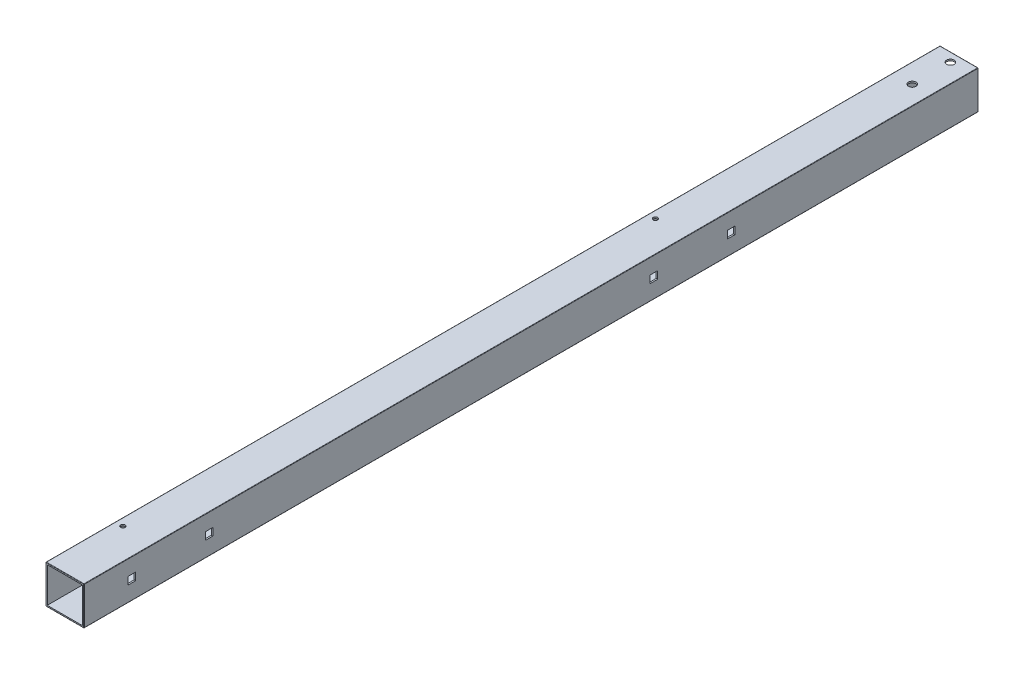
SolidWorks part; units mm, degrees
ref_plane "Plan de face" through (0, 0, 0) normal (0, 0, 1) x (1, 0, 0)
ref_plane "Plan de dessus" through (0, 0, 0) normal (0, 1, 0) x (1, 0, 0)
ref_plane "Plan de droite" through (0, 0, 0) normal (1, 0, 0) x (0, 0, -1)
sketch "Esquisse1" plane through (0, 0, 0) normal (0, 0, 1) x (1, 0, 0)
  line L0 (2, 49) -> (49, 49)
  line L1 (0, 0) -> (51, 0)
  line L2 (0, 0) -> (0, 51)
  line L3 (0, 51) -> (51, 51)
  line L4 (51, 0) -> (51, 51)
  line L5 (49, 2) -> (49, 49)
  line L6 (2, 2) -> (49, 2)
  line L7 (2, 2) -> (2, 49)
  dimension "D1" = 51
  dimension "D2" = 51
  dimension "D3" = 2
extrude "Extrusion1" add sketch "Esquisse1" along normal blind 1194
sketch "Esquisse2" plane through (51, 0, 0) normal (1, 0, 0) x (0, 0, -1)
  line L0 (-1194, 51) -> (0, 51) construction
  line L1 (-335, 30.5) -> (-325, 30.5)
  line L2 (-335, 30.5) -> (-335, 20.5)
  line L3 (-335, 20.5) -> (-325, 20.5)
  line L4 (-325, 30.5) -> (-325, 20.5)
  line L5 (-1032, 30.5) -> (-1022, 30.5)
  line L6 (0, 0) -> (0, 51) construction
  line L7 (-428, 30.5) -> (-428, 20.5)
  line L8 (-438, 30.5) -> (-438, 20.5)
  line L9 (-438, 30.5) -> (-428, 30.5)
  line L10 (-438, 20.5) -> (-428, 20.5)
  line L11 (-1032, 30.5) -> (-1032, 20.5)
  line L12 (-1032, 20.5) -> (-1022, 20.5)
  line L13 (-1022, 30.5) -> (-1022, 20.5)
  line L14 (-1125, 30.5) -> (-1125, 20.5)
  line L15 (-1135, 30.5) -> (-1135, 20.5)
  line L16 (-1135, 30.5) -> (-1125, 30.5)
  line L17 (-1135, 20.5) -> (-1125, 20.5)
  dimension "D1" = 20.5
  dimension "D2" = 10
  dimension "D3" = 10
  dimension "D4" = 325
extrude "Extrusion2" cut sketch "Esquisse2" against normal through all
sketch "Esquisse3" plane through (0, 51, 0) normal (0, 1, 0) x (1, 0, 0)
  line L0 (0, -1194) -> (0, 0) construction
  line L1 (51, -1194) -> (0, -1194) construction
  line L2 (51, 0) -> (0, 0) construction
  line L3 (51, -1194) -> (51, 0) construction
  circle A0 centre (10, -1101) radius 3
  circle A1 centre (10, -390) radius 3
  circle A2 centre (25.9, -12) radius 5
  circle A3 centre (25.9, -63) radius 5
  dimension "D1" = 10
  dimension "D2" = 6
  dimension "D3" = 93
  dimension "D4" = 10
  dimension "D5" = 390
  dimension "D6" = 6
  dimension "D7" = 10
  dimension "D8" = 10
  dimension "D9" = 12
  dimension "D10" = 63
  dimension "D11" = 25.1
  dimension "D12" = 25.1
extrude "Extrusion3" cut sketch "Esquisse3" against normal up to next
fillet "Congé1" radius 0.5 12 edges at (25.5, 0, 1194) (51, 25.5, 1194) (0, 25.5, 1194) (25.5, 51, 1194) (0, 0, 597) (25.5, 0, 0) (0, 25.5, 0) (25.5, 51, 0) (51, 25.5, 0) (51, 0, 597) (0, 51, 597) (51, 51, 597)
